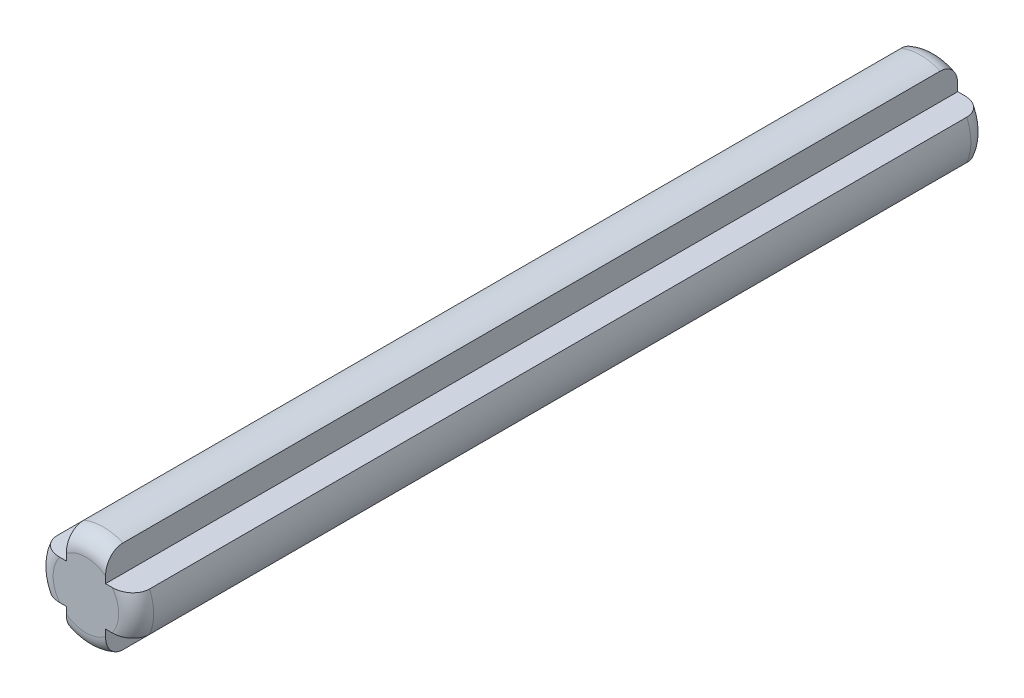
SolidWorks part; units mm, degrees
ref_plane "Front Plane" through (0, 0, 0) normal (0, 0, 1) x (1, 0, 0)
ref_plane "Top Plane" through (0, 0, 0) normal (0, 1, 0) x (1, 0, 0)
ref_plane "Right Plane" through (0, 0, 0) normal (1, 0, 0) x (0, 0, -1)
sketch "Sketch1" plane through (0, 0, 0) normal (0, 0, 1) x (1, 0, 0)
  line L0 (-0.9, 2.1166) -> (-0.9, 0.9)
  line L1 (-0.9, 0.9) -> (-2.1166, 0.9)
  line L2 (0, 3.8484) -> (0, -4.1163) construction
  line L3 (-3.3115, 0) -> (4.7978, 0) construction
  line L4 (-0.9, -2.1166) -> (-0.9, -0.9)
  line L5 (-0.9, -0.9) -> (-2.1166, -0.9)
  line L6 (0.9, -2.1166) -> (0.9, -0.9)
  line L7 (0.9, -0.9) -> (2.1166, -0.9)
  line L8 (0.9, 2.1166) -> (0.9, 0.9)
  line L9 (0.9, 0.9) -> (2.1166, 0.9)
  circle A0 centre (0, 0) radius 2.3
  dimension "D1" = 4.6
  dimension "D2" = 0.9
  dimension "D3" = 0.9
extrude "Boss-Extrude1" add sketch "Sketch1" against normal blind 39 contours L8 A0 L0 L1 L5 L4 L6 L7 L9
fillet "Fillet1" radius 0.8 8 edges at (2.3, 0, -39) (0, 2.3, -39) (-2.3, 0, -39) (2.3, 0, 0) (0, -2.3, -39) (0, -2.3, 0) (-2.3, 0, 0) (0, 2.3, 0)
